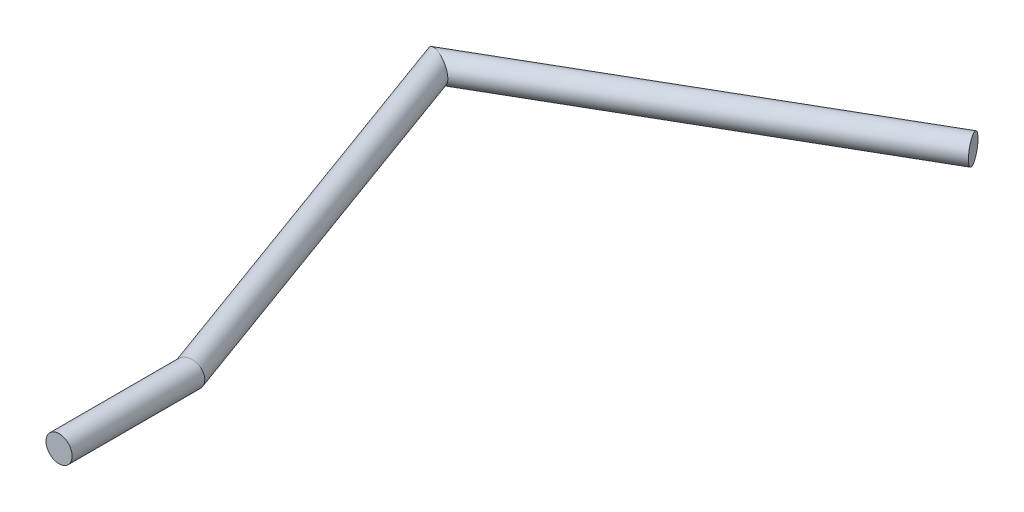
SolidWorks part; units mm, degrees
ref_plane "Front Plane" through (0, 0, 0) normal (0, 0, 1) x (1, 0, 0)
ref_plane "Top Plane" through (0, 0, 0) normal (0, 1, 0) x (1, 0, 0)
ref_plane "Right Plane" through (0, 0, 0) normal (1, 0, 0) x (0, 0, -1)
sketch "Sketch1" plane through (0, 0, 0) normal (0, 1, 0) x (1, 0, 0)
  line L0 (0, 0) -> (0, 49.8845)
  line L2 (0, 49.8845) -> (-54.3412, 199.1857)
  line L3 (-54.3412, 199.1857) -> (75.5626, 274.1857)
  dimension "D1" = 150
  dimension "D4" = 80
  dimension "D5" = 20
sketch "Sketch2" plane through (0, 0, 0) normal (0, 0, 1) x (1, 0, 0)
  circle A0 centre (0, 0) radius 5
  dimension "D1" = 10
sweep "Sweep1" add profiles "Sketch2" path "Sketch1"
